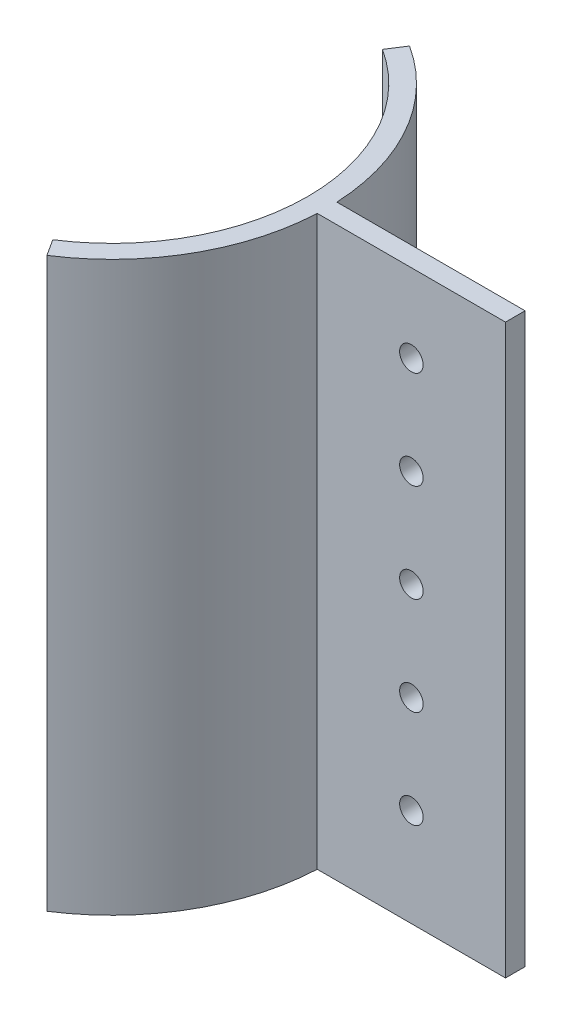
SolidWorks part; units mm, degrees
other "Connection Feature"
ref_plane "Front Plane" through (0, 0, 0) normal (0, 0, 1) x (1, 0, 0)
ref_plane "Top Plane" through (0, 0, 0) normal (0, 1, 0) x (1, 0, 0)
ref_plane "Right Plane" through (0, 0, 0) normal (1, 0, 0) x (0, 0, -1)
sketch "Sketch1" plane through (0, 0, 0) normal (0, 1, 0) x (1, 0, 0)
  line L0 (0, 0) -> (13.5076, -21.0368) construction
  line L1 (0, 0) -> (13.5076, 21.0368) construction
  line L2 (0, 0) -> (25, 0) construction
  circle A0 centre (0, 0) radius 25 construction
  arc A1 (13.5076, 21.0368) -> (13.5076, -21.0368) centre (0, 0) cw
  dimension "D1" = 50
  dimension "D2" = 50
extrude "Extrude-Thin1" add sketch "Sketch1" along normal mid plane 72.5 thin
sketch "Sketch2" plane through (0, 0, 0) normal (0, 0, 1) x (1, 0, 0)
  line L0 (27.5, 36.25) -> (14.8583, 36.25) construction
  line L1 (26.5, 36.25) -> (51.5, 36.25)
  line L2 (26.5, 36.25) -> (26.5, -36.25)
  line L3 (26.5, -36.25) -> (51.5, -36.25)
  line L4 (51.5, 36.25) -> (51.5, -36.25)
  line L5 (14.8583, -36.25) -> (27.5, -36.25) construction
  line L6 (25, -36.25) -> (25, 36.25) construction
  dimension "D1" = 1.5
  dimension "D2" = 25
extrude "Boss-Extrude1" add sketch "Sketch2" along normal mid plane 2.5 contours L4 L3 L2 L1
hole_wizard "Ø3.0mm Dowel Hole1" positions "Sketch3" profile "Sketch4" hole size "Ø3.0" standard "ANSI Metric"
sketch "Sketch3" plane through (0, 0, 1.25) normal (0, 0, 1) x (1, 0, 0)
  line L0 (39.4858, 36.25) -> (39.4858, -36.25) construction
  line L1 (27.4716, 36.25) -> (51.5, 36.25) construction
  line L2 (27.4716, -36.25) -> (51.5, -36.25) construction
  point P0 (39.4858, 26.25)
  dimension "D1" = 10
sketch "Sketch4" plane through (39.4858, 26.25, 1.25) normal (1, 0, 0) x (0, -1, 0)
  line L0 (0, 0) -> (0, 2.5)
  line L1 (0, 2.5) -> (1.525, 2.5)
  line L2 (1.5, 2.475) -> (1.5, 0)
  line L5 (1.5, 0) -> (0, 0)
  line L7 (1.525, 2.5) -> (1.5, 2.475)
  line L8 (-1.525, 2.5) -> (-1.5, 2.475) construction
  line L11 (0, -6.35) -> (0, 107.95) construction
  dimension "Thru Hole Dia." = 3
  dimension "Thru Hole Depth" = 2.5
  dimension "Far C'Sink Dia." = 3.05
  dimension "Far C'Sink Angle" = 90
pattern_linear "LPattern1" count 5 spacing 12.5 along (0, -1, 0) of "Ø3.0mm Dowel Hole1"
other "Configuration Table"
